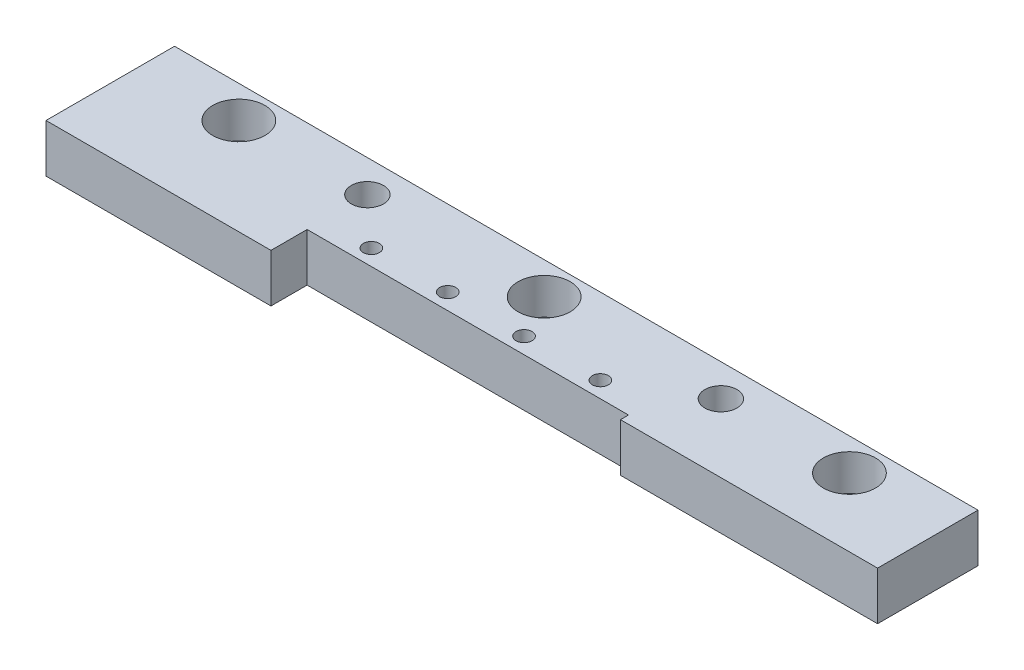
SolidWorks part; units mm, degrees
ref_plane "前视基准面" through (0, 0, 0) normal (0, 0, 1) x (1, 0, 0)
ref_plane "上视基准面" through (0, 0, 0) normal (0, 1, 0) x (1, 0, 0)
ref_plane "右视基准面" through (0, 0, 0) normal (1, 0, 0) x (0, 0, -1)
sketch "草图1" plane through (0, 0, 0) normal (0, 0, 1) x (1, 0, 0)
  line L0 (0, 0) -> (100, 0)
  line L1 (0, 6) -> (100, 6)
  line L2 (0, 0) -> (0, 6)
  line L3 (100, 0) -> (100, 6)
extrude "凸台-拉伸1" add sketch "草图1" along normal blind 16
sketch "草图2" plane through (0, 6, 0) normal (0, 1, 0) x (1, 0, 0)
  line L0 (0, 0) -> (100, 0)
  line L1 (100, -12.5) -> (100, 0)
  line L2 (0, -16) -> (0, 0)
  line L3 (68, -12.5) -> (100, -12.5)
  line L4 (0, -16) -> (28, -16)
  line L5 (28, -16) -> (28, -11.5)
  line L6 (28, -11.5) -> (68, -11.5)
  line L7 (68, -11.5) -> (68, -12.5)
  circle A0 centre (62.5, -9.5) radius 1
  circle A1 centre (53, -9.5) radius 1
  circle A2 centre (43.5, -9.5) radius 1
  circle A3 centre (34, -9.5) radius 1
  circle A4 centre (12, -4) radius 1.75
  circle A5 centre (88, -4) radius 1.75
  circle A6 centre (50, -4) radius 1.75
  circle A7 centre (28, -4) radius 2
  circle A8 centre (72, -4) radius 2
extrude "切除-拉伸1" cut sketch "草图2" against normal blind 16 flip side to cut
sketch "草图3" plane through (0, 6, 0) normal (0, 1, 0) x (1, 0, 0)
  circle A0 centre (12, -4) radius 3.25
  circle A1 centre (88, -4) radius 3.25
  circle A2 centre (50, -4) radius 3.25
extrude "切除-拉伸2" cut sketch "草图3" against normal blind 4.5
